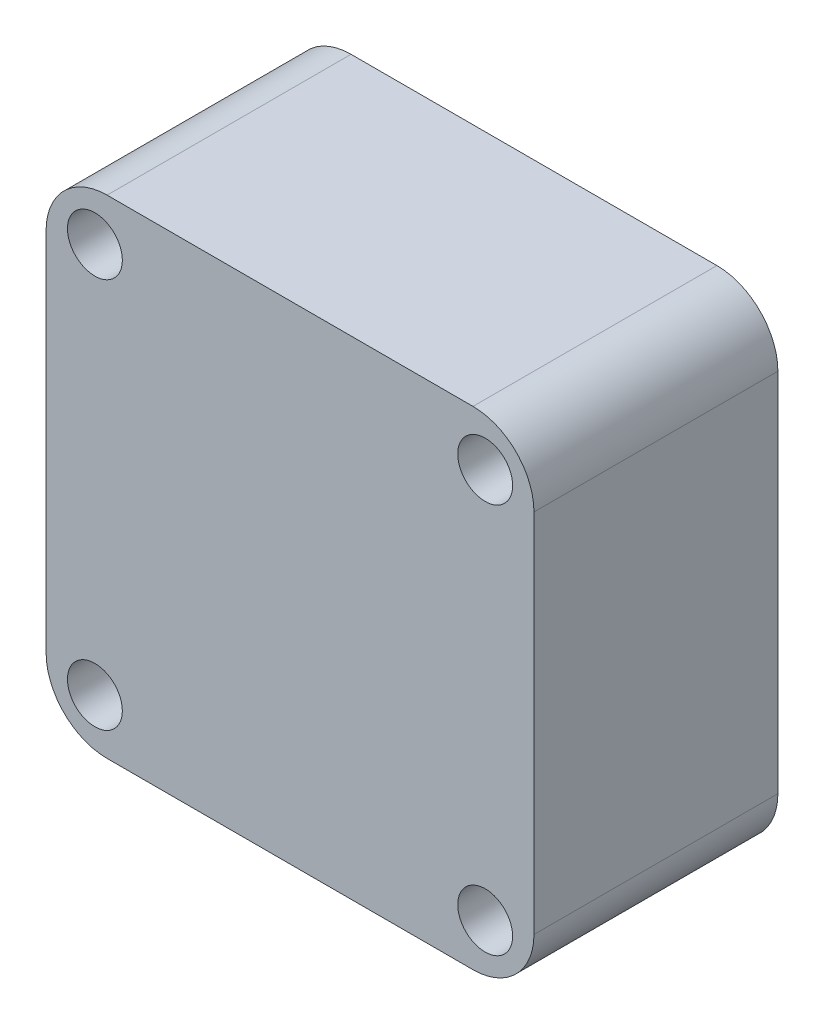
SolidWorks part; units mm, degrees
ref_plane "Přední rovina" through (0, 0, 0) normal (0, 0, 1) x (1, 0, 0)
ref_plane "Horní rovina" through (0, 0, 0) normal (0, 1, 0) x (1, 0, 0)
ref_plane "Pravá rovina" through (0, 0, 0) normal (1, 0, 0) x (0, 0, -1)
sketch "Skica1" plane through (0, 0, 0) normal (0, 0, 1) x (1, 0, 0)
  line L1 (-20, 20) -> (20, 20)
  line L2 (-20, 20) -> (-20, -20)
  line L3 (-20, -20) -> (20, -20)
  line L4 (20, 20) -> (20, -20)
  line L5 (-20, 20) -> (20, -20) construction
  line L6 (-20, -20) -> (20, 20) construction
  line L7 (-16, 16) -> (16, 16) construction
  line L8 (-16, 16) -> (-16, -16) construction
  line L9 (-16, -16) -> (16, -16) construction
  line L10 (16, 16) -> (16, -16) construction
  line L11 (-16, 16) -> (16, -16) construction
  line L12 (-16, -16) -> (16, 16) construction
  circle A0 centre (-16, 16) radius 2.25
  circle A1 centre (16, 16) radius 2.25
  circle A2 centre (16, -16) radius 2.25
  circle A3 centre (-16, -16) radius 2.25
  point P0 (0, 0)
  point P5 (0, 0)
  dimension "D5" = 4.5
  dimension "D1" = 40
  dimension "D2" = 40
  dimension "D3" = 32
  dimension "D4" = 32
extrude "Přidat vysunutím1" add sketch "Skica1" along normal blind 20 from offset 0
fillet "Zaoblit2" radius 5 1 edges at (-20, 20, 10)
fillet "Zaoblit3" radius 5 3 edges at (-20, -20, 10) (20, -20, 10) (20, 20, 10)
sketch "Skica2" plane through (0, 0, 0) normal (0, 0, -1) x (-1, 0, 0)
  line L0 (22.0158, -125.8311) -> (21.9898, 102.1689) construction
  line L1 (20.4895, 105.1687) -> (-97.5105, 105.1553) construction
  circle A0 centre (0.0015, 0.1664) radius 18.5 construction
  dimension "D1" = 22
  dimension "D2" = 37
  dimension "D3" = 105
